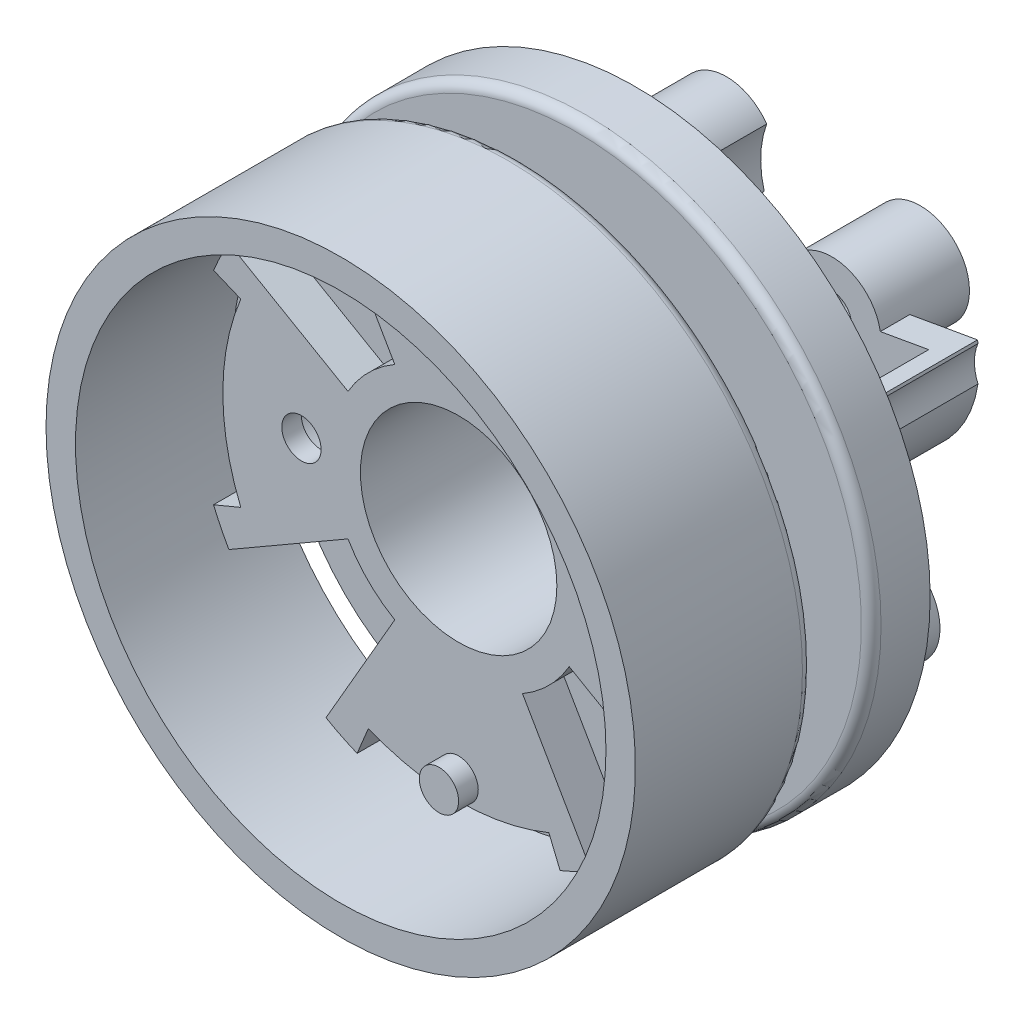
SolidWorks part; units mm, degrees
ref_plane "Face" through (0, 0, 0) normal (0, 0, 1) x (1, 0, 0)
ref_plane "Dessus" through (0, 0, 0) normal (0, 1, 0) x (1, 0, 0)
ref_plane "Droite" through (0, 0, 0) normal (1, 0, 0) x (0, 0, -1)
sketch "Esquisse1" plane through (0, 0, 0) normal (0, 0, 1) x (1, 0, 0)
  circle A0 centre (0, 0) radius 15
  dimension "D1" = 30
extrude "Centrage moteur" add sketch "Esquisse1" along normal mid plane 9
sketch "Esquisse3" plane through (0, 0, -4.5) normal (0, 0, 1) x (1, 0, 0)
  circle A0 centre (0, 0) radius 8
  dimension "D1" = 16
extrude "Gorge poulie" add sketch "Esquisse3" against normal blind 3
sketch "Esquisse4" plane through (0, 0, -7.5) normal (0, 0, -1) x (-1, 0, 0)
  circle A0 centre (0, 0) radius 15
  circle A1 centre (0, 0) radius 15 construction
extrude "Centrage couvercle" add sketch "Esquisse4" along normal blind 3
sketch "Esquisse5" plane through (0, 0, -10.5) normal (0, 0, -1) x (-1, 0, 0)
  circle A0 centre (0, 0) radius 14
  dimension "D1" = 28
extrude "Lamage couvercle" cut sketch "Esquisse5" against normal blind 1.5
sketch "Esquisse6" plane through (0, 0, -9) normal (0, 0, -1) x (-1, 0, 0)
  circle A0 centre (0, 0) radius 6
  dimension "D1" = 12
extrude "Bossage pignon moteur" add sketch "Esquisse6" along normal blind 13
sketch "Esquisse2" plane through (0, 0, 4.5) normal (0, 0, 1) x (1, 0, 0)
  circle A0 centre (0, 0) radius 13.5
  dimension "D1" = 27
extrude "Lamage moteur" cut sketch "Esquisse2" against normal blind 6
sketch "Esquisse7" plane through (0, 0, -1.5) normal (0, 0, 1) x (1, 0, 0)
  circle A0 centre (0, 0) radius 5
  circle A1 centre (0, 0) radius 13.5 construction
  dimension "D1" = 10
extrude "Logement pignon moteur" cut sketch "Esquisse7" against normal blind 19
sketch "Esquisse8" plane through (0, 0, -22) normal (0, 0, -1) x (-1, 0, 0)
  line L0 (0, 0) -> (0, 9.3444) construction
  line L1 (0, 0) -> (5.9088, 1.0419)
  line L2 (0, 0) -> (-5.9088, 1.0419)
  circle A1 centre (0, 0) radius 6 construction
  arc A2 (5.9088, 1.0419) -> (-5.9088, 1.0419) centre (0, 0) ccw
  dimension "D1" = 160
extrude "Lumiere" cut sketch "Esquisse8" against normal up to surface (13 mm away)
sketch "Esquisse9" plane through (0, 0, -20.5) normal (0, 0, 1) x (1, 0, 0)
  circle A0 centre (0, 0) radius 2.5
  dimension "D1" = 5
extrude "Bossage axe de sortie" add sketch "Esquisse9" against normal blind 4.5
sketch "Esquisse10" plane through (0, 0, -25) normal (0, 0, -1) x (-1, 0, 0)
  circle A0 centre (0, 0) radius 1
  dimension "D1" = 2
extrude "Passage axe de sortie" cut sketch "Esquisse10" against normal through all
sketch "Esquisse11" plane through (0, 0, -1.5) normal (0, 0, 1) x (1, 0, 0)
  line L0 (0, 0) -> (13.5, 0) construction
  line L1 (0, 0) -> (12.4724, 5.1662) construction
  line L2 (0, 0) -> (12.4724, -5.1662) construction
  circle A1 centre (0, 0) radius 13.5
  arc A2 (12.4724, -5.1662) -> (12.4724, 5.1662) centre (0, 0) ccw
  dimension "D2" = 45
  dimension "D1" = 0
extrude "Creux 1" cut sketch "Esquisse11" against normal blind 2 thin
sketch "Esquisse12" plane through (0, 0, -1.5) normal (0, 0, 1) x (1, 0, 0)
  line L0 (0, 0) -> (9.5459, 9.5459) construction
  line L1 (15.4875, 0) -> (-15.4875, 0) construction
  line L2 (0, 0) -> (11.6913, 6.75) construction
  line L3 (0, 0) -> (6.75, 11.6913) construction
  circle A0 centre (0, 0) radius 13.5 construction
  arc A1 (11.6913, 6.75) -> (6.75, 11.6913) centre (0, 0) ccw
  dimension "D1" = 45
  dimension "D2" = 30
extrude "Creux 2" cut sketch "Esquisse12" against normal blind 2 and the other way through all thin
sketch "Esquisse13" plane through (0, 0, -3.5) normal (0, 0, 1) x (1, 0, 0)
  arc A0 (11.6913, 6.75) -> (6.75, 11.6913) centre (0, 0) ccw construction
  arc A1 (11.6913, 6.75) -> (6.75, 11.6913) centre (0, 0) ccw
extrude "Creux 3" cut sketch "Esquisse13" against normal up to next thin
pattern_circular "Répétition creux" count 4 over 360
sketch "Esquisse14" plane through (0, 0, -1.5) normal (0, 0, 1) x (1, 0, 0)
  circle A0 centre (0, -11) radius 1
  dimension "D1" = 2
  dimension "D2" = 11
extrude "Détrompage" add sketch "Esquisse14" along normal blind 1
sketch "Esquisse15" plane through (0, 0, -1.5) normal (0, 0, 1) x (1, 0, 0)
  circle A0 centre (8, 0) radius 1
  dimension "D1" = 2
  dimension "D2" = 8
extrude "Passage vis moteur" cut sketch "Esquisse15" against normal through all
sketch "Esquisse16" plane through (0, 0, -22) normal (0, 0, -1) x (-1, 0, 0)
  circle A0 centre (-8, 0) radius 2.25
  circle A1 centre (-8, 0) radius 1 construction
  dimension "D1" = 4.5
extrude "Lamage vis moteur" cut sketch "Esquisse16" against normal offset from surface (19.5 mm away) 1
pattern_circular "Répétition vis moteur" count 2 over 360
sketch "Esquisse17" plane through (0, 0, -9) normal (0, 0, -1) x (-1, 0, 0)
  circle A0 centre (-3.375, 6.9765) radius 2.5
  dimension "D1" = 5
  dimension "D2" = 3.375
  dimension "D3" = 7.75
extrude "Bossage axe intermédiaire" add sketch "Esquisse17" along normal blind 3 thin
sketch "Esquisse18" plane through (0, 0, -9) normal (0, 0, -1) x (-1, 0, 0)
  circle A0 centre (3.3692, 7.2559) radius 2.5
  dimension "D1" = 5
  dimension "D2" = 6.75
  dimension "D3" = 8
extrude "Bossage axe intermédiaire 2" add sketch "Esquisse18" along normal blind 9.5 thin
sketch "Esquisse19" plane through (0, 0, -12) normal (0, 0, -1) x (-1, 0, 0)
  circle A0 centre (-3.375, 6.9765) radius 5
  dimension "D1" = 10
extrude "Dégagement roue dentée" cut sketch "Esquisse19" along normal through all
sketch "Esquisse20" plane through (0, 0, -9) normal (0, 0, -1) x (-1, 0, 0)
  line L0 (0, 0) -> (9.5, -4.6335) construction
  line L1 (0, 15.4875) -> (0, -15.4875) construction
  circle A0 centre (9.5, -4.6335) radius 2.5
  dimension "D2" = 5
  dimension "D1" = 9.5
  dimension "D3" = 64
extrude "Bossage couvercle" add sketch "Esquisse20" along normal blind 5 thin
pattern_circular "Répétition bossage couvercle" count 2 every 128
fillet "Congés" radius 0.5
sketch "Esquisse21" plane through (0, 0, -1.5) normal (0, 0, 1) x (1, 0, 0)
  circle A0 centre (0, 10) radius 1
  dimension "D2" = 2
  dimension "D1" = 10
extrude "Bloque ficelle" add sketch "Esquisse21" against normal up to surface (6 mm away)
